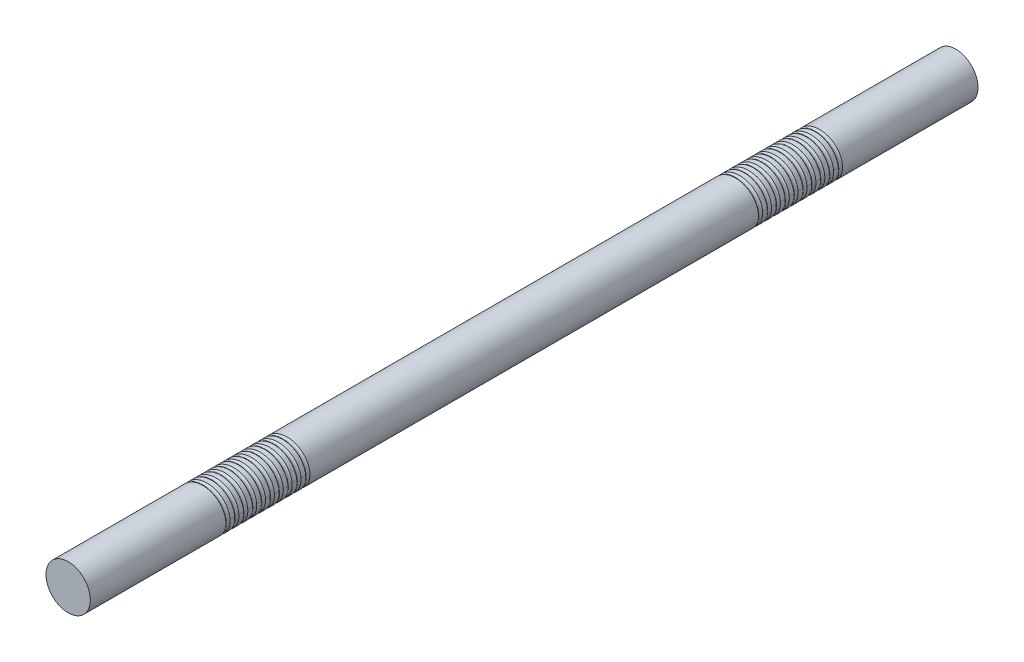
SolidWorks part; units mm, degrees
ref_plane "Front Plane" through (0, 0, 0) normal (0, 0, 1) x (1, 0, 0)
ref_plane "Top Plane" through (0, 0, 0) normal (0, 1, 0) x (1, 0, 0)
ref_plane "Right Plane" through (0, 0, 0) normal (1, 0, 0) x (0, 0, -1)
sketch "Sketch1" plane through (0, 0, 0) normal (0, 0, 1) x (1, 0, 0)
  circle A0 centre (0, 0) radius 25
  dimension "D1" = 50
extrude "Boss-Extrude1" add sketch "Sketch1" along normal blind 1000
ref_plane "Plane1" through (0, 0, 150) normal (0, 0, 1) x (1, 0, 0)
sketch "Sketch2" plane through (0, 0, 150) normal (0, 0, 1) x (1, 0, 0)
  circle A0 centre (0, 0) radius 27.1167
  dimension "D1" = 54.2333
curve "Helix/Spiral1"
sketch "Sketch3" plane through (0, 0, 0) normal (0, 1, 0) x (1, 0, 0)
  circle A0 centre (-27.1167, -150) radius 3.175
  spline S0 degree 3 number of poles 233 (-27.1167, -150) -> (-27.1167, -250) construction
  dimension "D1" = 6.35
sweep "Cut-Sweep1" cut profiles "Sketch3" path "Helix/Spiral1"
pattern_linear "LPattern1" count 2 spacing 600 along (0, 0, -1) of "Cut-Sweep1"
